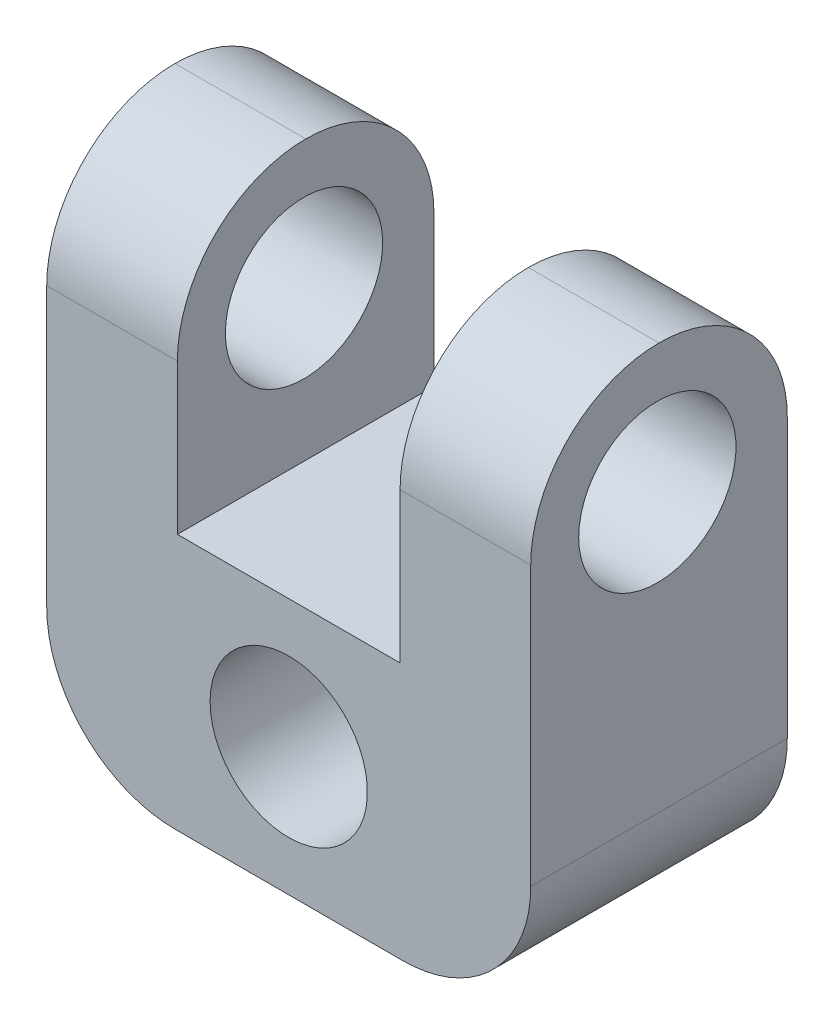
SolidWorks part; units mm, degrees
ref_plane "Piano frontale" through (0, 0, 0) normal (0, 0, 1) x (1, 0, 0)
ref_plane "Piano superiore" through (0, 0, 0) normal (0, 1, 0) x (1, 0, 0)
ref_plane "Piano destro" through (0, 0, 0) normal (1, 0, 0) x (0, 0, -1)
sketch "Schizzo1" plane through (0, 0, 0) normal (0, 0, 1) x (1, 0, 0)
  line L1 (-5, -2.65) -> (5, -2.65)
  line L2 (-5, -2.65) -> (-5, 2.65)
  line L3 (-5, 2.65) -> (5, 2.65)
  line L4 (5, -2.65) -> (5, 2.65)
  line L5 (-5, -2.65) -> (5, 2.65) construction
  line L6 (-5, 2.65) -> (5, -2.65) construction
  circle A0 centre (0, 0) radius 1.625
  point P0 (0, 0)
  dimension "D3" = 3.25
  dimension "D1" = 5.3
  dimension "D2" = 10
extrude "Estrusione-Estrusione1" add sketch "Schizzo1" along normal blind 5.3 contours L2 L1 L4 L3
sketch "Schizzo2" plane through (0, 0, 0) normal (0, 0, -1) x (-1, 0, 0)
  circle A0 centre (0, 0) radius 1.625
  dimension "D1" = 3.25
extrude "Taglio-Estrusione3" cut sketch "Schizzo2" against normal through all
sketch "Schizzo3" plane through (0, 2.65, 0) normal (0, 1, 0) x (1, 0, 0)
  line L1 (2.3, 0) -> (5, 0)
  line L2 (2.3, 0) -> (2.3, -5.3)
  line L3 (2.3, -5.3) -> (5, -5.3)
  line L4 (5, 0) -> (5, -5.3)
  line L5 (5, -5.3) -> (5, 0) construction
  line L6 (-5, -5.3) -> (5, -5.3) construction
  line L7 (-5, -5.3) -> (5, -5.3) construction
  line L8 (-5, 0) -> (-2.3, 0)
  line L9 (-5, 0) -> (-5, -5.3)
  line L10 (-5, -5.3) -> (-2.3, -5.3)
  line L11 (-2.3, 0) -> (-2.3, -5.3)
  dimension "D1" = 2.7
  dimension "D2" = 2.7
extrude "Estrusione-Estrusione2" add sketch "Schizzo3" along normal blind 5.75
sketch "Schizzo4" plane through (-5, 0, 0) normal (-1, 0, 0) x (0, 0, 1)
  line L0 (5.3, -2.65) -> (0, -2.65) construction
  circle A0 centre (2.6844, 5.75) radius 1.625
  point P4 (2.65, -2.65)
  dimension "D1" = 3.25
  dimension "D2" = 8.4
extrude "Taglio-Estrusione4" cut sketch "Schizzo4" against normal through all
fillet "Raccordo2" radius 2.65 4 edges at (3.65, 8.4, 0) (3.65, 8.4, 5.3) (-3.65, 8.4, 5.3) (-3.65, 8.4, 0)
fillet "Raccordo3" radius 2.65 2 edges at (-5, -2.65, 2.65) (5, -2.65, 2.65)
